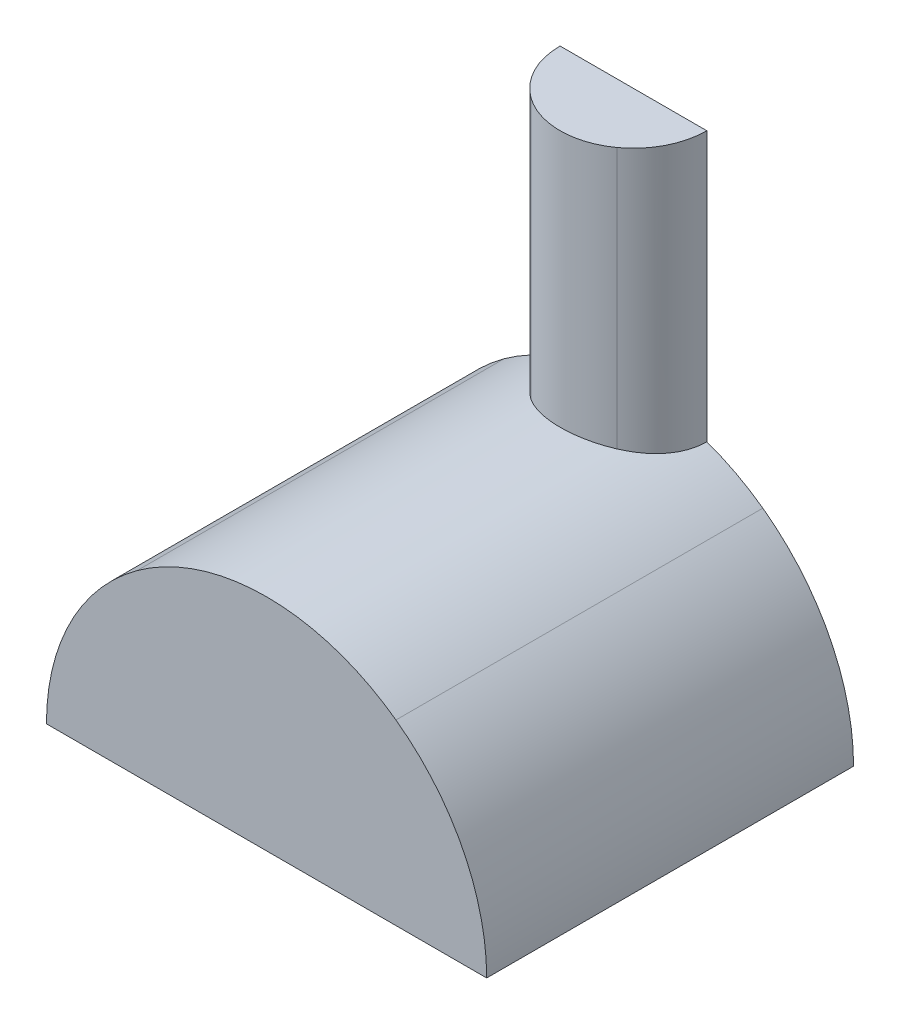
SolidWorks part; units mm, degrees
ref_plane "Front Plane" through (0, 0, 0) normal (0, 0, 1) x (1, 0, 0)
ref_plane "Top Plane" through (0, 0, 0) normal (0, 1, 0) x (1, 0, 0)
ref_plane "Right Plane" through (0, 0, 0) normal (1, 0, 0) x (0, 0, -1)
sketch "Sketch1" plane through (0, 0, 0) normal (0, 0, 1) x (1, 0, 0)
  line L0 (-1524, 0) -> (1524, 0)
  arc A0 (1524, 0) -> (-1524, 0) centre (0, 0) ccw
  dimension "D1" = 3048
extrude "Boss-Extrude1" add sketch "Sketch1" along normal blind 2540
sketch "Sketch2" plane through (0, 0, 0) normal (0, -1, 0) x (1, 0, 0)
  line L0 (-1524, 0) -> (1524, 0) construction
  line L1 (508, 0) -> (-508, 0)
  arc A0 (508, 0) -> (-508, 0) centre (0, 0) ccw
  dimension "D1" = 508
extrude "Boss-Extrude2" add sketch "Sketch2" against normal blind 3302
sketch "Sketch3" plane through (0, 0, 0) normal (0, -1, 0) x (1, 0, 0)
  line L0 (-1524, 0) -> (1524, 0) construction
  line L1 (-1524, 2540) -> (-1524, 0) construction
  circle A0 centre (-254, 1905) radius 317.5
  dimension "D3" = 635
  dimension "D1" = 1905
  dimension "D2" = 1270
extrude "Cut-Extrude1" [suppressed] cut sketch "Sketch3" against normal through all
ref_point "Point1" parameters "D1"=1436.3362
ref_point "Point2" parameters "D1"=3351.451
ref_plane "Plane2" through (-895.7847, 0, 0) normal (1, 0, 0) x (0, 0, -1)
ref_plane "Plane3" through (895.7847, 0, 0) normal (1, 0, 0) x (0, 0, -1)
ref_point "Point3"
ref_point "Point4" parameters "D1"=478.7787
ref_plane "Plane4" through (-298.5949, 0, 0) normal (1, 0, 0) x (0, 0, -1)
ref_plane "Plane5" through (298.5949, 0, 0) normal (1, 0, 0) x (0, 0, -1)
